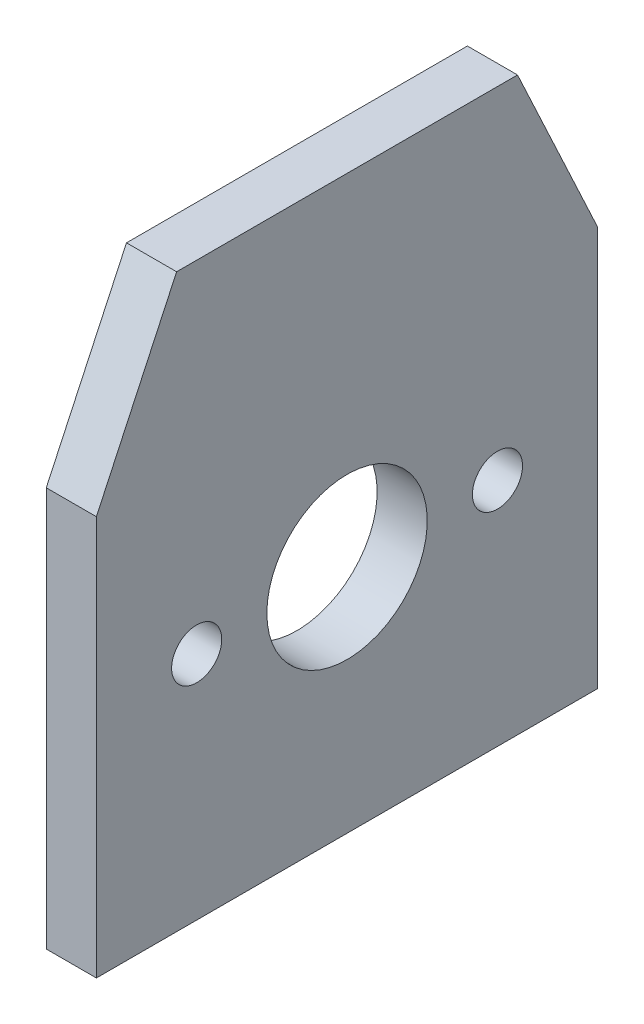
SolidWorks part; units mm, degrees
ref_plane "Front Plane" through (0, 0, 0) normal (0, 0, 1) x (1, 0, 0)
ref_plane "Top Plane" through (0, 0, 0) normal (0, 1, 0) x (1, 0, 0)
ref_plane "Right Plane" through (0, 0, 0) normal (1, 0, 0) x (0, 0, -1)
sketch "Sketch1" plane through (0, 0, 0) normal (1, 0, 0) x (0, 0, -1)
  line L0 (0, 0) -> (0, 48.2812) construction
  line L1 (-25, 39.8439) -> (-17, 57)
  line L3 (-25, 39.8439) -> (-25, 0)
  line L4 (-25, 0) -> (25, 0)
  line L5 (25, 39.8439) -> (25, 0)
  line L6 (-17, 57) -> (17, 57)
  line L7 (17, 57) -> (25, 39.8439)
  dimension "D1" = 50
  dimension "D2" = 57
  dimension "D3" = 34
  dimension "D4" = 25
extrude "Boss-Extrude1" add sketch "Sketch1" along normal blind 5
sketch "Sketch2" plane through (0, 0, 0) normal (-1, 0, 0) x (0, 0, 1)
  line L0 (0, 0) -> (0, 38.6928) construction
  circle A0 centre (0, 23) radius 8
  circle A1 centre (-15, 23) radius 2.5
  circle A2 centre (15, 23) radius 2.5
  dimension "D1" = 16
  dimension "D2" = 5
  dimension "D3" = 30
  dimension "D4" = 23
extrude "Cut-Extrude1" cut sketch "Sketch2" against normal through all
